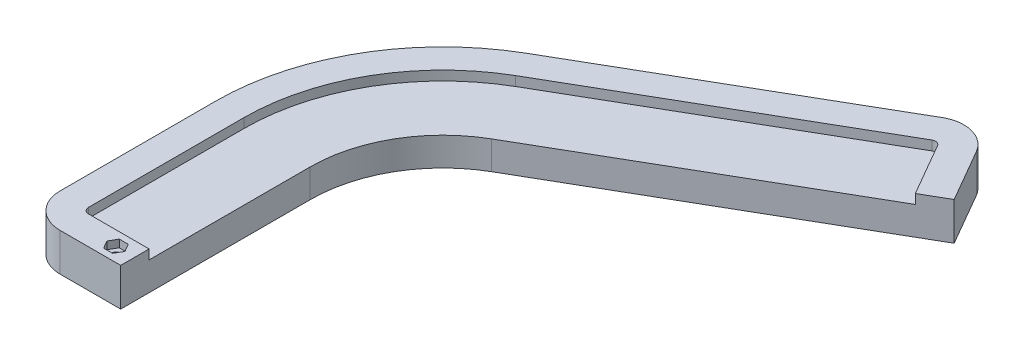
SolidWorks part; units mm, degrees
ref_plane "Front" through (0, 0, 0) normal (0, 0, 1) x (1, 0, 0)
ref_plane "Top" through (0, 0, 0) normal (0, 1, 0) x (1, 0, 0)
ref_plane "Right" through (0, 0, 0) normal (1, 0, 0) x (0, 0, -1)
sketch "Sketch2" plane through (0, 0, 0) normal (0, 1, 0) x (1, 0, 0)
  line L0 (0, 0) -> (0, 100)
  line L1 (35, 160.6218) -> (189.8076, 250)
  line L2 (10, 203.923) -> (164.8076, 293.3013)
  line L3 (-50, 0) -> (-50, 100)
  line L4 (164.8076, 293.3013) -> (189.8076, 250)
  line L5 (-50, 0) -> (0, 0)
  arc A0 (0, 100) -> (35, 160.6218) centre (70, 100) cw
  arc A1 (-50, 100) -> (10, 203.923) centre (70, 100) cw
  dimension "D2" = 70
  dimension "D1" = 120
  dimension "D3" = 250
  dimension "D4" = 100
  dimension "D5" = 50
extrude "Extrude1" add sketch "Sketch2" along normal blind 20
fillet "Fillet1" radius 18 2 edges at (164.8076, 10, -293.3013) (-50, 10, 0)
shell "Shell1" thickness 15
sketch "Sketch21" plane through (17.4999, 20, -35.237) normal (0, 1, 0) x (-1, 0, 0)
  line L1 (29.8815, 23.612) -> (32.263, 27.737)
  line L2 (32.263, 27.737) -> (29.8815, 31.862)
  line L3 (29.8815, 31.862) -> (25.1183, 31.862)
  line L4 (25.1183, 31.862) -> (22.7368, 27.737)
  line L5 (22.7368, 27.737) -> (25.1183, 23.612)
  line L6 (25.1183, 23.612) -> (29.8815, 23.612)
  line L7 (17.4999, 35.237) -> (17.4999, 20.237) construction
  line L8 (27.4999, 27.737) -> (17.4999, 27.737) construction
  line L9 (49.4999, 35.237) -> (17.4999, 35.237) construction
  circle A0 centre (27.4999, 27.737) radius 4.125 construction
  dimension "D1" = 10
  dimension "D2" = 8.25
extrude "Hex" cut sketch "Sketch21" against normal blind 4
sketch "Sketch4" plane through (17.4999, 16, -35.237) normal (0, 1, 0) x (-1, 0, 0)
  circle A0 centre (27.4999, 27.737) radius 2
  dimension "D1" = 4
extrude "Thru" cut sketch "Sketch4" against normal through all
other "Hex_Cut1"
